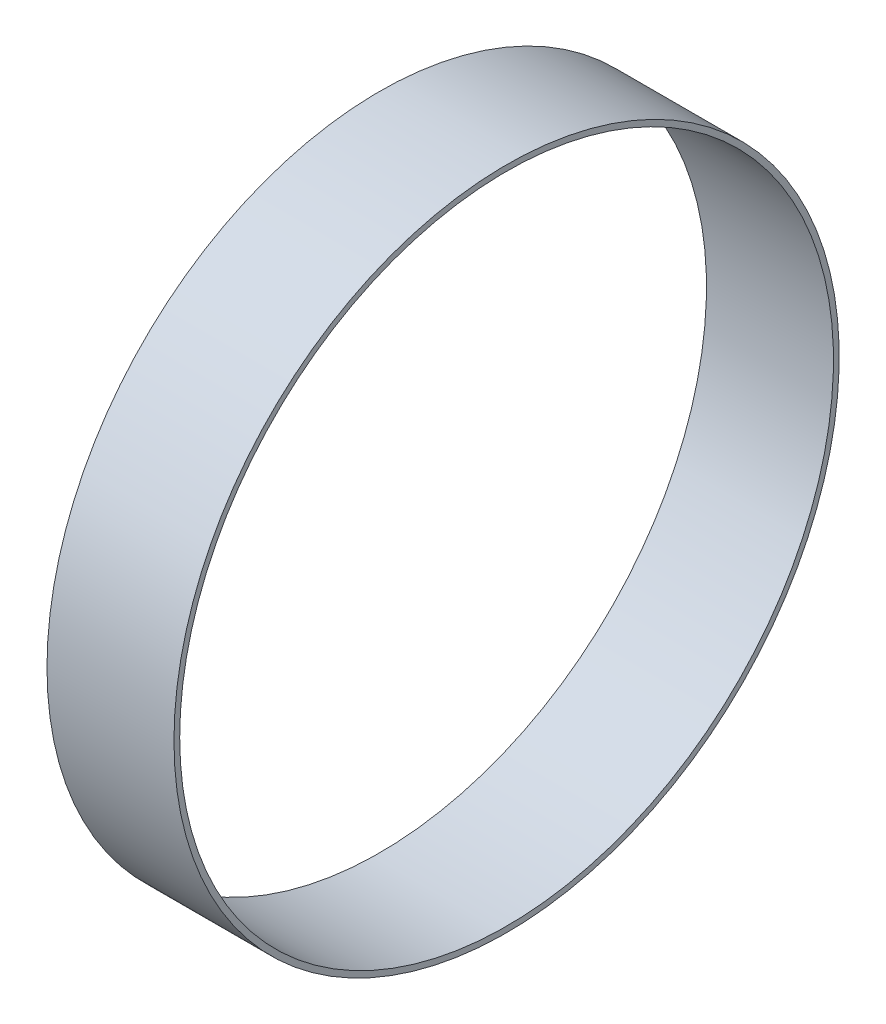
SolidWorks part; units mm, degrees
ref_plane "Front Plane" through (0, 0, 0) normal (0, 0, 1) x (1, 0, 0)
ref_plane "Top Plane" through (0, 0, 0) normal (0, 1, 0) x (1, 0, 0)
ref_plane "Right Plane" through (0, 0, 0) normal (1, 0, 0) x (0, 0, -1)
sketch "Sketch1" plane through (0, 0, 0) normal (1, 0, 0) x (0, 0, -1)
  circle A0 centre (0, 0) radius 147.2438
  circle A1 centre (0, 0) radius 144.7038
  dimension "D1" = 294.4876
  dimension "D2" = 2.54
extrude "Boss-Extrude1" add sketch "Sketch1" along normal blind 56.2102
